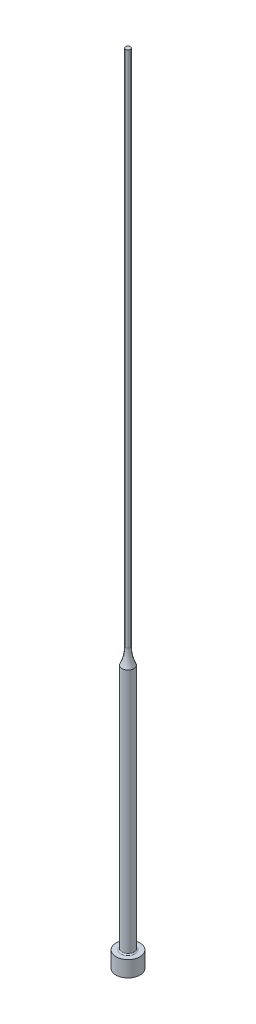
SolidWorks part; units mm, degrees
ref_plane "Front Plane" through (0, 0, 0) normal (0, 0, 1) x (1, 0, 0)
ref_plane "Top Plane" through (0, 0, 0) normal (0, 1, 0) x (1, 0, 0)
ref_plane "Right Plane" through (0, 0, 0) normal (1, 0, 0) x (0, 0, -1)
sketch "Sketch1" plane through (0, 0, 0) normal (0, 0, 1) x (1, 0, 0)
  line L0 (0, 0) -> (3, 0)
  line L1 (55, 0) -> (-55, 0) construction
  line L2 (3, 0) -> (3, 4)
  line L3 (3, 4) -> (1.8, 4)
  line L4 (1.5, 4.3) -> (1.5, 65.8539)
  line L6 (0.6, 70) -> (0.6, 200)
  line L7 (0.6, 200) -> (0, 200)
  line L8 (0, 200) -> (0, 0)
  arc A0 (0.6, 70) -> (1.5, 65.8539) centre (10.6, 70) ccw
  arc A1 (1.8, 4) -> (1.5, 4.3) centre (1.8, 4.3) cw
  dimension "D7" = 70
  dimension "D8" = 0.3
  dimension "D5" = 10
  dimension "D1" = 0.6
  dimension "D2" = 1.5
  dimension "D3" = 3
  dimension "D4" = 4
  dimension "D6" = 200
revolve "Revolve1" add sketch "Sketch1" angle 360 about L8
